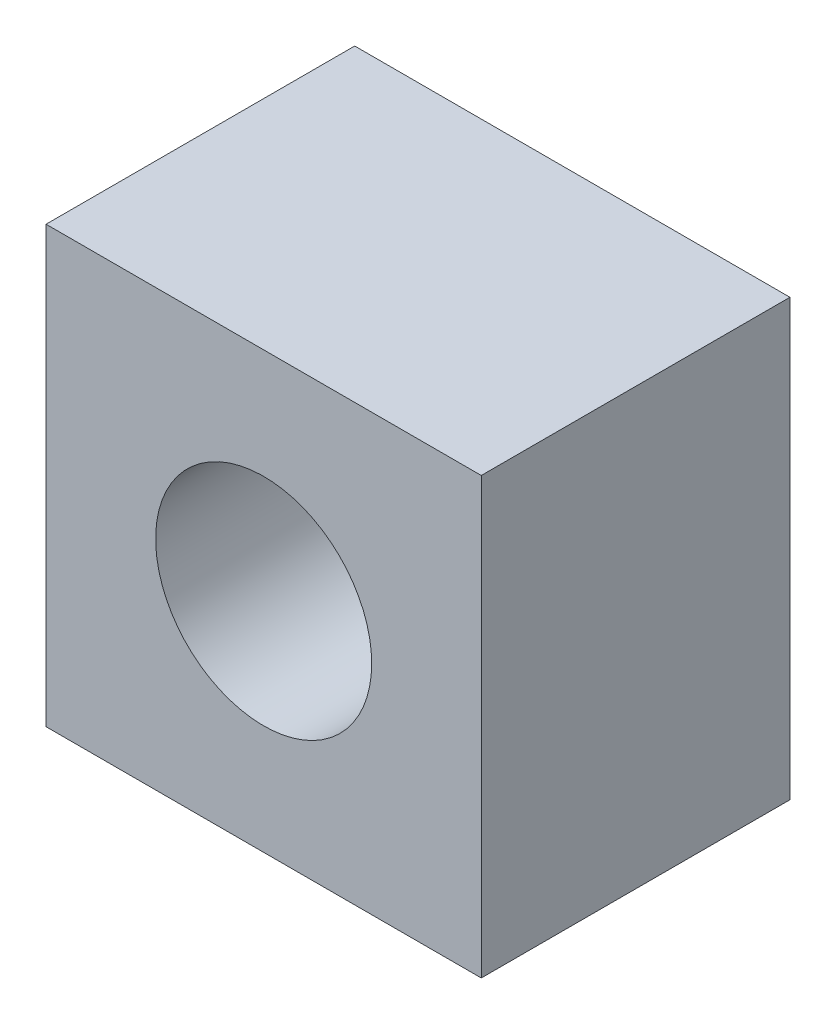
SolidWorks part; units mm, degrees
ref_plane "Face" through (0, 0, 0) normal (0, 0, 1) x (1, 0, 0)
ref_plane "Dessus" through (0, 0, 0) normal (0, 1, 0) x (1, 0, 0)
ref_plane "Droite" through (0, 0, 0) normal (1, 0, 0) x (0, 0, -1)
sketch "Esquisse1" plane through (0, 0, 0) normal (0, 0, 1) x (1, 0, 0)
  line L1 (-7.05, 7.05) -> (7.05, 7.05)
  line L2 (-7.05, 7.05) -> (-7.05, -7.05)
  line L3 (-7.05, -7.05) -> (7.05, -7.05)
  line L4 (7.05, 7.05) -> (7.05, -7.05)
  circle A0 centre (0, 0) radius 3.5
  dimension "D5" = 7
  dimension "D1" = 7.05
  dimension "D2" = 7.05
  dimension "D3" = 7.05
  dimension "D4" = 7.05
extrude "Extrusion1" add sketch "Esquisse1" along normal blind 10
